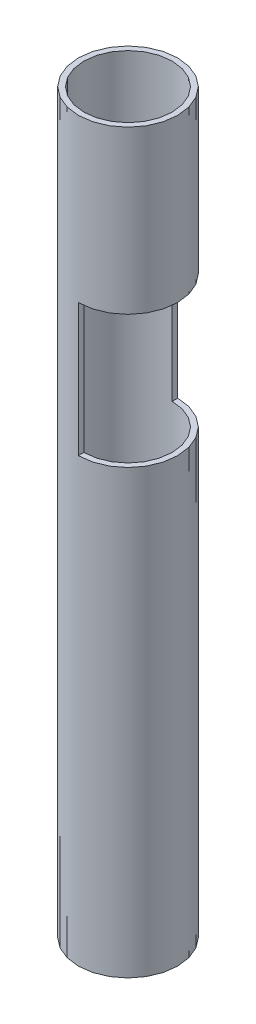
SolidWorks part; units mm, degrees
ref_plane "Front Plane" through (0, 0, 0) normal (0, 0, 1) x (1, 0, 0)
ref_plane "Top Plane" through (0, 0, 0) normal (0, 1, 0) x (1, 0, 0)
ref_plane "Right Plane" through (0, 0, 0) normal (1, 0, 0) x (0, 0, -1)
sketch "Sketch1" plane through (0, 0, 0) normal (0, 1, 0) x (1, 0, 0)
  circle A0 centre (0, 0) radius 13.5
  circle A1 centre (0, 0) radius 12
  dimension "D1" = 27
  dimension "D2" = 24
extrude "Boss-Extrude1" add sketch "Sketch1" along normal blind 350
ref_plane "Plane1" through (20, 0, 0) normal (1, 0, 0) x (0, 0, -1)
sketch "Sketch2" plane through (20, 0, 0) normal (1, 0, 0) x (0, 0, -1)
  line L0 (-13.5, 156) -> (13.5, 156)
  line L1 (-13.5, 350) -> (-13.5, 0) construction
  line L2 (13.5, 0) -> (13.5, 350) construction
  line L3 (13.5, 156) -> (13.5, 120)
  line L4 (13.5, 120) -> (-13.5, 120)
  line L5 (-13.5, 120) -> (-13.5, 156)
  dimension "D1" = 120
  dimension "D2" = 36
extrude "Cut-Extrude1" cut sketch "Sketch2" against normal blind 20
thread "Thread2" pitch 0.3 start angle 0, offset 0, length 10, pitch 0.3, diameter 24
ref_plane "Plane5" through (12, 0, 0) normal (0, 0, 1) x (1, 0, 0)
sketch "Thread Profile4" plane through (12, 0, 0) normal (0, 0, 1) x (1, 0, 0)
  line L0 (0, 0) -> (0, 0.3) construction
  line L11 (0, 0) -> (0, 0.2625)
  line L12 (0, 0.2625) -> (-0.1624, 0.1687)
  line L13 (-0.1624, 0.1687) -> (-0.1624, 0.0937)
  line L15 (-0.1624, 0.0937) -> (0, 0)
  line L17 (-0.1624, 0.1312) -> (0, 0.1312) construction
  point P2 (0, 0)
  dimension "Pitch" = 0.3
  dimension "Profile_Angle" = 60
  dimension "Profile_Land" = 0.075
  dimension "Profile_Height" = 0.1624
sketch "Sketch3" plane through (0, 0, 0) normal (0, 0, 1) x (1, 0, 0)
  line L0 (13.5, 156) -> (13.5, 350) construction
  line L1 (-13.5, 350) -> (13.5, 350)
  line L2 (-13.5, 350) -> (-13.5, 200)
  line L3 (-13.5, 200) -> (13.5, 200)
  line L4 (13.5, 350) -> (13.5, 200)
  dimension "D1" = 150
extrude "Cut-Extrude2" cut sketch "Sketch3" against normal through all both and the other way through all
